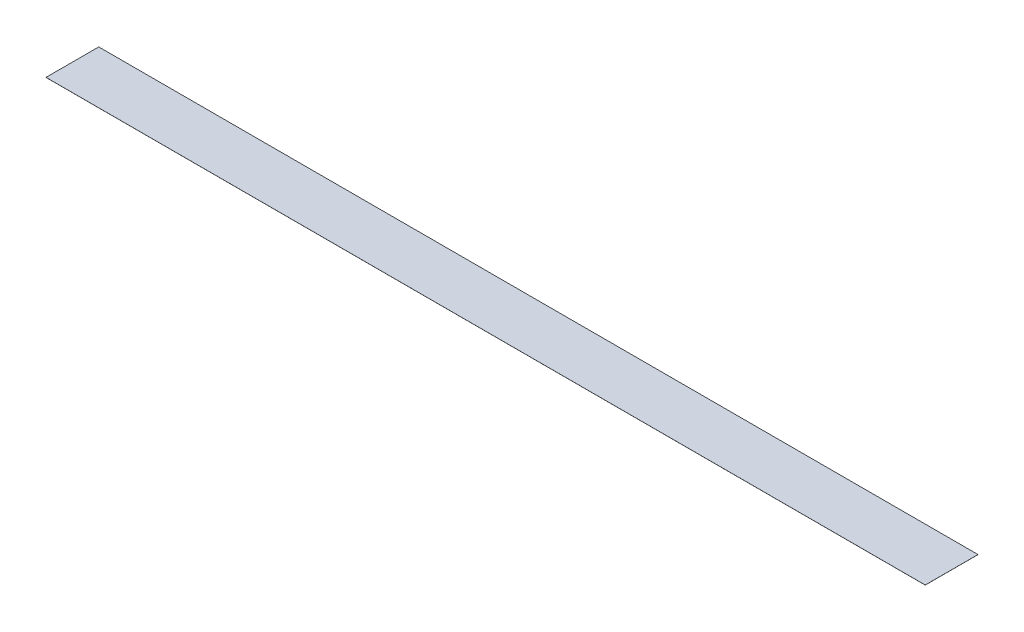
SolidWorks part; units mm, degrees
ref_plane "Front" through (0, 0, 0) normal (0, 0, 1) x (1, 0, 0)
ref_plane "Top" through (0, 0, 0) normal (0, 1, 0) x (1, 0, 0)
ref_plane "Right" through (0, 0, 0) normal (1, 0, 0) x (0, 0, -1)
sketch "Sketch1" plane through (0, 0, 0) normal (0, 1, 0) x (1, 0, 0)
  line L1 (0, -381) -> (12700, -381)
  line L2 (0, -381) -> (0, 381)
  line L3 (0, 381) -> (12700, 381)
  line L4 (12700, -381) -> (12700, 381)
  dimension "D1" = 12700
  dimension "D2" = 762
  dimension "D3" = 381
extrude "Extrude1" add sketch "Sketch1" against normal blind 1
